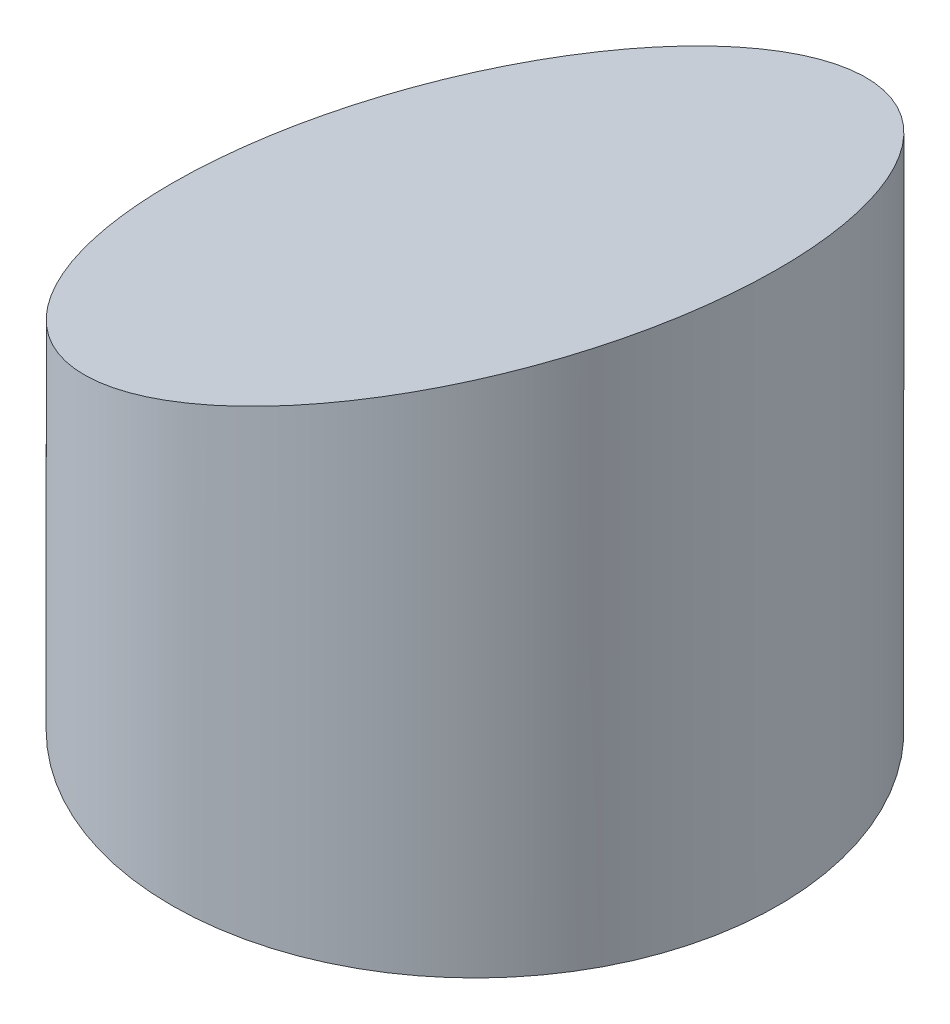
SolidWorks part; units mm, degrees
ref_plane "XY-Vorderansicht" through (0, 0, 0) normal (0, 0, 1) x (1, 0, 0)
ref_plane "XZ-Draufsicht" through (0, 0, 0) normal (0, 1, 0) x (1, 0, 0)
ref_plane "YZ-Seitenansicht" through (0, 0, 0) normal (1, 0, 0) x (0, 0, -1)
sketch "Skizze1" plane through (0, 0, 0) normal (0, 1, 0) x (1, 0, 0)
  circle A0 centre (0, 0) radius 42.7769
extrude "Linear austragen1" add sketch "Skizze1" along normal blind 100
sketch "Skizze2" plane through (0, 0, 0) normal (0, 0, 1) x (1, 0, 0)
  line L0 (-49.6612, 42.8324) -> (54.0496, 82.0348)
ref_plane "Ebene1" through (-20.375, 53.9025, 0) normal (0.3536, -0.9354, 0) x (0.9354, 0.3536, 0)
other "Oberflächenschnitt1" parameters "Dicke"=5
